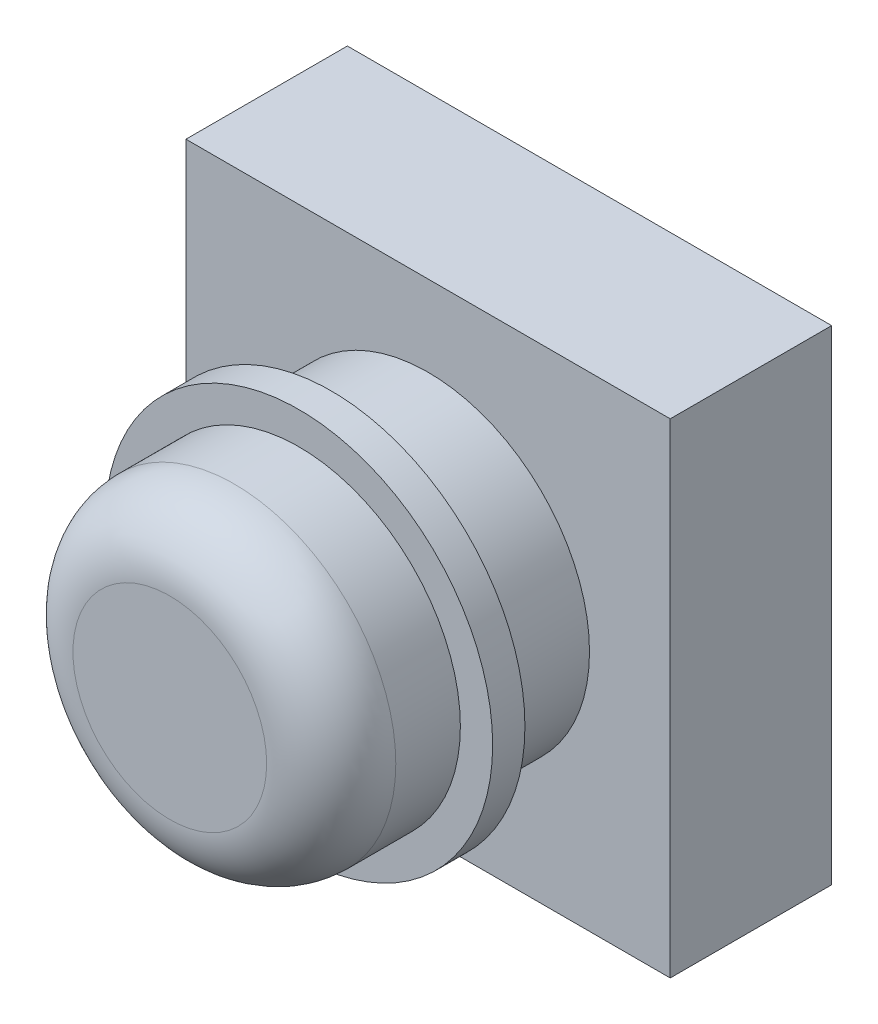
SolidWorks part; units mm, degrees
ref_plane "Front" through (0, 0, 0) normal (0, 0, 1) x (1, 0, 0)
ref_plane "Top" through (0, 0, 0) normal (0, 1, 0) x (1, 0, 0)
ref_plane "Right" through (0, 0, 0) normal (1, 0, 0) x (0, 0, -1)
sketch "Sketch1" plane through (0, 0, 0) normal (0, 0, 1) x (1, 0, 0)
  line L0 (-7.5, 7.5) -> (7.5, 7.5)
  line L1 (-7.5, 7.5) -> (-7.5, -7.5)
  line L2 (7.5, -7.5) -> (-7.5, -7.5)
  line L3 (7.5, -7.5) -> (7.5, 7.5)
  line L4 (-7.5, -7.5) -> (7.5, 7.5) construction
  line L5 (-7.5, 7.5) -> (7.5, -7.5) construction
  point P4 (0, 0)
  dimension "D1" = 15
  dimension "D2" = 15
extrude "Base-Extrude" add sketch "Sketch1" along normal blind 5
sketch "Sketch2" plane through (0, 0, 5) normal (0, 0, 1) x (1, 0, 0)
  circle A0 centre (0, 0) radius 5
  dimension "D1" = 10
extrude "Boss-Extrude1" add sketch "Sketch2" along normal blind 8
fillet "Fillet2" radius 2
ref_plane "Plane4" through (0, 0, 8) normal (0, 0, 1) x (1, 0, 0)
sketch "Sketch4" plane through (0, 0, 8) normal (0, 0, 1) x (1, 0, 0)
  circle A0 centre (0, 0) radius 5 construction
  circle A1 centre (0, 0) radius 5
  circle A3 centre (0, 0) radius 6
  circle A4 centre (0, 0) radius 6
  dimension "D1" = 1
extrude "Boss-Extrude2" add sketch "Sketch4" along normal blind 1
